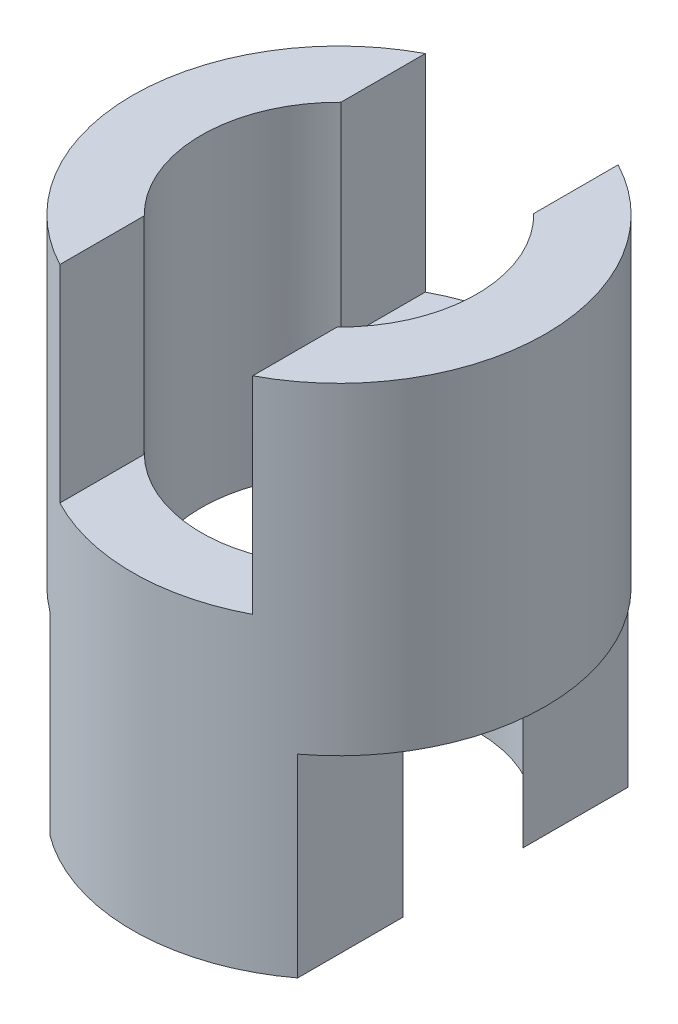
SolidWorks part; units mm, degrees
ref_plane "前视基准面" through (0, 0, 0) normal (0, 0, 1) x (1, 0, 0)
ref_plane "上视基准面" through (0, 0, 0) normal (0, 1, 0) x (1, 0, 0)
ref_plane "右视基准面" through (0, 0, 0) normal (1, 0, 0) x (0, 0, -1)
sketch "草图1" plane through (0, 0, 0) normal (0, 1, 0) x (1, 0, 0)
  circle A0 centre (0, 0) radius 30
  dimension "D1" = 60
extrude "拉伸1" add sketch "草图1" along normal blind 75
sketch "草图3" plane through (0, 75, 0) normal (0, 1, 0) x (1, 0, 0)
  line L0 (0, 0) -> (0, 66.573) construction
  line L1 (-14, 47.2951) -> (14, 47.2951)
  line L2 (-14, 47.2951) -> (-14, -52.1788)
  line L3 (-14, -52.1788) -> (14, -52.1788)
  line L4 (14, 47.2951) -> (14, -52.1788)
  line L5 (0, 66.573) -> (0, -57.8337) construction
  dimension "D1" = 28
extrude "切除-拉伸2" cut sketch "草图3" against normal blind 30
sketch "草图4" plane through (0, 0, 0) normal (0, -1, 0) x (1, 0, 0)
  circle A0 centre (0, 0) radius 20
  dimension "D1" = 40
extrude "切除-拉伸3" cut sketch "草图4" against normal through all
sketch "草图5" plane through (0, 0, 0) normal (0, 0, 1) x (1, 0, 0)
  line L0 (-30, 75) -> (-30, 0) construction
  line L1 (-36.9865, 28.1587) -> (-18, 28.1587)
  line L2 (-36.9865, 28.1587) -> (-36.9865, -4.0424)
  line L3 (-36.9865, -4.0424) -> (-18, -4.0424)
  line L4 (-18, 28.1587) -> (-18, -4.0424)
  line L5 (31.2146, 28.1587) -> (18, 28.1587)
  line L6 (31.2146, 28.1587) -> (31.2146, -4.0424)
  line L7 (31.2146, -4.0424) -> (18, -4.0424)
  line L8 (18, 28.1587) -> (18, -4.0424)
  line L9 (30, 0) -> (30, 75) construction
  dimension "D1" = 12
  dimension "D2" = 12
extrude "切除-拉伸4" cut sketch "草图5" against normal through all and the other way through all
